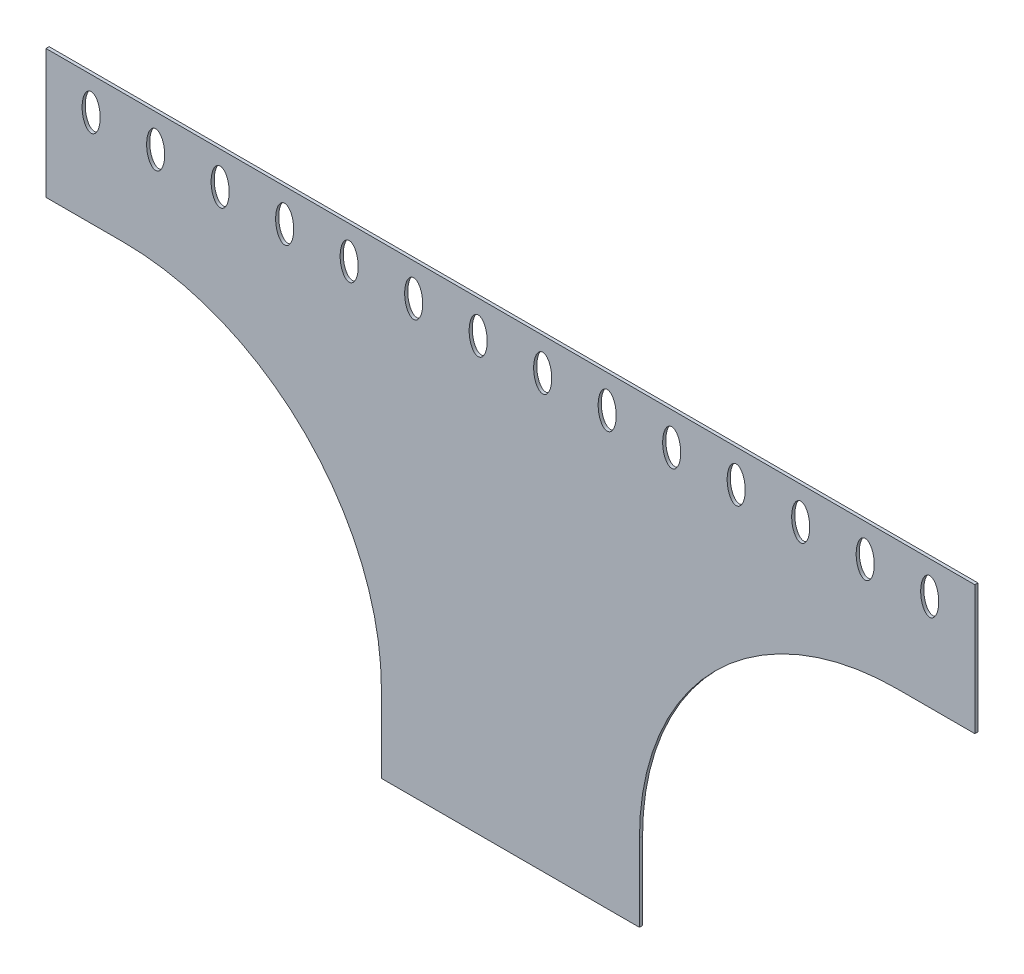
SolidWorks part; units mm, degrees
ref_plane "Front Plane" through (0, 0, 0) normal (0, 0, 1) x (1, 0, 0)
ref_plane "Top Plane" through (0, 0, 0) normal (0, 1, 0) x (1, 0, 0)
ref_plane "Right Plane" through (0, 0, 0) normal (1, 0, 0) x (0, 0, -1)
sketch "Sketch1" plane through (0, 0, 0) normal (0, 0, 1) x (1, 0, 0)
  line L0 (0, 0) -> (100, 0)
  line L1 (100, 0) -> (100, 30)
  line L2 (200, 130) -> (230, 130)
  line L3 (230, 130) -> (230, 180)
  line L4 (230, 180) -> (-130, 180)
  line L5 (-130, 180) -> (-130, 130)
  line L6 (-130, 130) -> (-100, 130)
  line L7 (0, 30) -> (0, 0)
  arc A0 (100, 30) -> (200, 130) centre (200, 30) cw
  arc A1 (-100, 130) -> (0, 30) centre (-100, 30) cw
  dimension "D4" = 100
  dimension "D1" = 30
  dimension "D2" = 100
  dimension "D3" = 180
  dimension "D5" = 360
sheet metal parameters "Sheet-Metal1" thickness 1.2141 parameters "D1"=1.27
base flange "Base-Flange1" sketch "Sketch1" thickness 1.2141 reverse thickness direction yes parameters "D1"=1.27
sketch "Sketch2" plane through (0, 0, 1.2141) normal (0, 0, 1) x (1, 0, 0)
  line L2 (230, 180) -> (-130, 180) construction
  line L4 (50, 180) -> (50, 167.3) construction
  line L5 (50, 167.3) -> (62.5, 167.3) construction
  ellipse E0 centre (62.5, 167.3) end of major axis (62.5, 174.3) minor radius 3.5
  dimension "D1" = 7
  dimension "D2" = 14
  dimension "D3" = 12.5
  dimension "D4" = 12.7
extrude "Extrude1" cut sketch "Sketch2" against normal blind 10
pattern_linear "LPattern1" count 21 spacing 25 along (-1, 0, 0) count 20 spacing 25 along (-1, 0, 0) of "Extrude1"
flat pattern "Flat-Pattern1"
sketch "Bend-Lines1" plane through (0, 0, 0) normal (0, 1, 0) x (-1, 0, 0)
